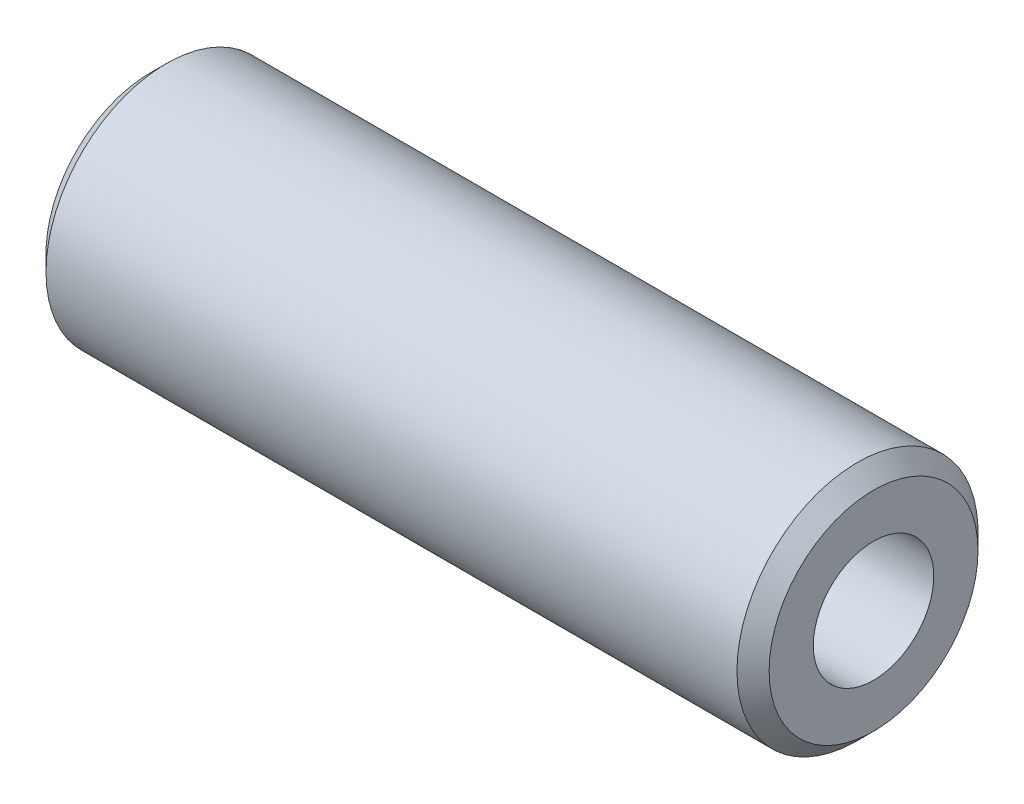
SolidWorks part; units mm, degrees
ref_plane "Front Plane" through (0, 0, 0) normal (0, 0, 1) x (1, 0, 0)
ref_plane "Top Plane" through (0, 0, 0) normal (0, 1, 0) x (1, 0, 0)
ref_plane "Right Plane" through (0, 0, 0) normal (1, 0, 0) x (0, 0, -1)
sketch "Sketch1" plane through (0, 0, 0) normal (1, 0, 0) x (0, 0, -1)
  circle A0 centre (0, 0) radius 7.5
  circle A1 centre (0, 0) radius 15
  dimension "D1" = 30
  dimension "D2" = 15
extrude "Boss-Extrude1" add sketch "Sketch1" along normal mid plane 90
chamfer "Chamfer1" distance 2 2 edges at (-45, 0, -15) (45, 0, -15)
